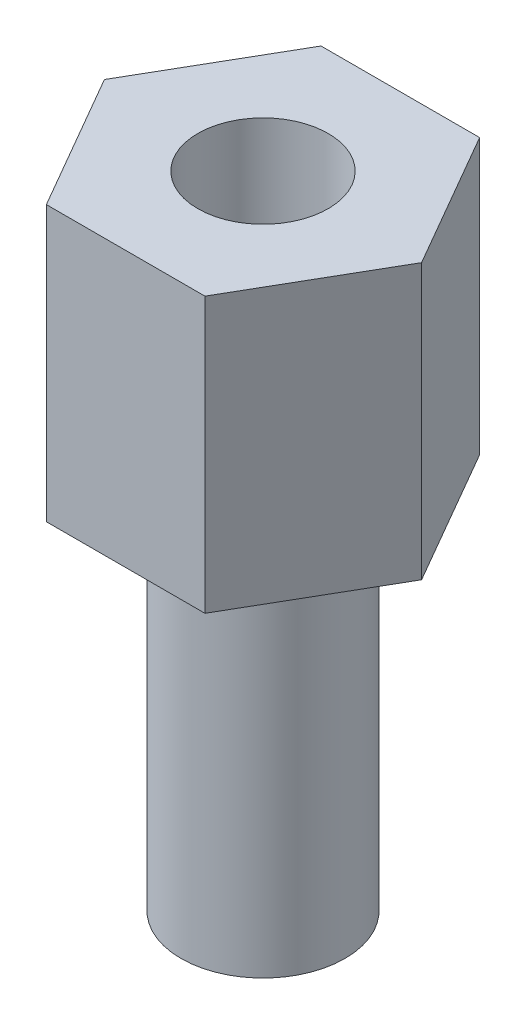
SolidWorks part; units mm, degrees
ref_plane "Front" through (0, 0, 0) normal (0, 0, 1) x (1, 0, 0)
ref_plane "Top" through (0, 0, 0) normal (0, 1, 0) x (1, 0, 0)
ref_plane "Right" through (0, 0, 0) normal (1, 0, 0) x (0, 0, -1)
sketch "Sketch1" plane through (0, 0, 0) normal (0, 1, 0) x (1, 0, 0)
  line L1 (2.7496, 0) -> (1.3748, 2.3813)
  line L2 (1.3748, 2.3813) -> (-1.3748, 2.3813)
  line L3 (-1.3748, 2.3813) -> (-2.7496, 0)
  line L4 (-2.7496, 0) -> (-1.3748, -2.3813)
  line L5 (-1.3748, -2.3813) -> (1.3748, -2.3813)
  line L6 (1.3748, -2.3813) -> (2.7496, 0)
  circle A0 centre (0, 0) radius 2.3812 construction
  dimension "D1" = 4.7625
extrude "Boss-Extrude1" add sketch "Sketch1" along normal blind 4.7625
hole_wizard "#4-40 Tapped Hole1" positions "Sketch3" profile "Sketch2" tap size "#4-40" standard "Ansi Inch"
sketch "Sketch3" plane through (0, 4.7625, 0) normal (0, 1, 0) x (-1, 0, 0)
  point P0 (0, 0)
sketch "Sketch2" plane through (0, 4.7625, 0) normal (1, 0, 0) x (0, 0, 1)
  line L0 (0, 0) -> (0, 4.0574)
  line L1 (0, 4.0574) -> (1.1303, 3.3782)
  line L2 (1.1303, 3.3782) -> (1.1303, 0)
  line L5 (1.1303, 0) -> (0, 0)
  line L10 (0, 4.0574) -> (-1.1303, 3.3782) construction
  line L11 (0, -6.35) -> (0, 107.95) construction
  dimension "Tap Drill Dia." = 2.2606
  dimension "Tap Drill Depth" = 3.3782
  dimension "Drill Angle" = 118
sketch "Sketch4" plane through (0, 0, 0) normal (0, -1, 0) x (1, 0, 0)
  circle A0 centre (0, 0) radius 1.4224
  dimension "D1" = 2.8448
extrude "Boss-Extrude2" add sketch "Sketch4" along normal blind 6.35
equation "\"Buoyancy\"=\"SW-Volume\"*(\"SW-Density\"-.037062)"
